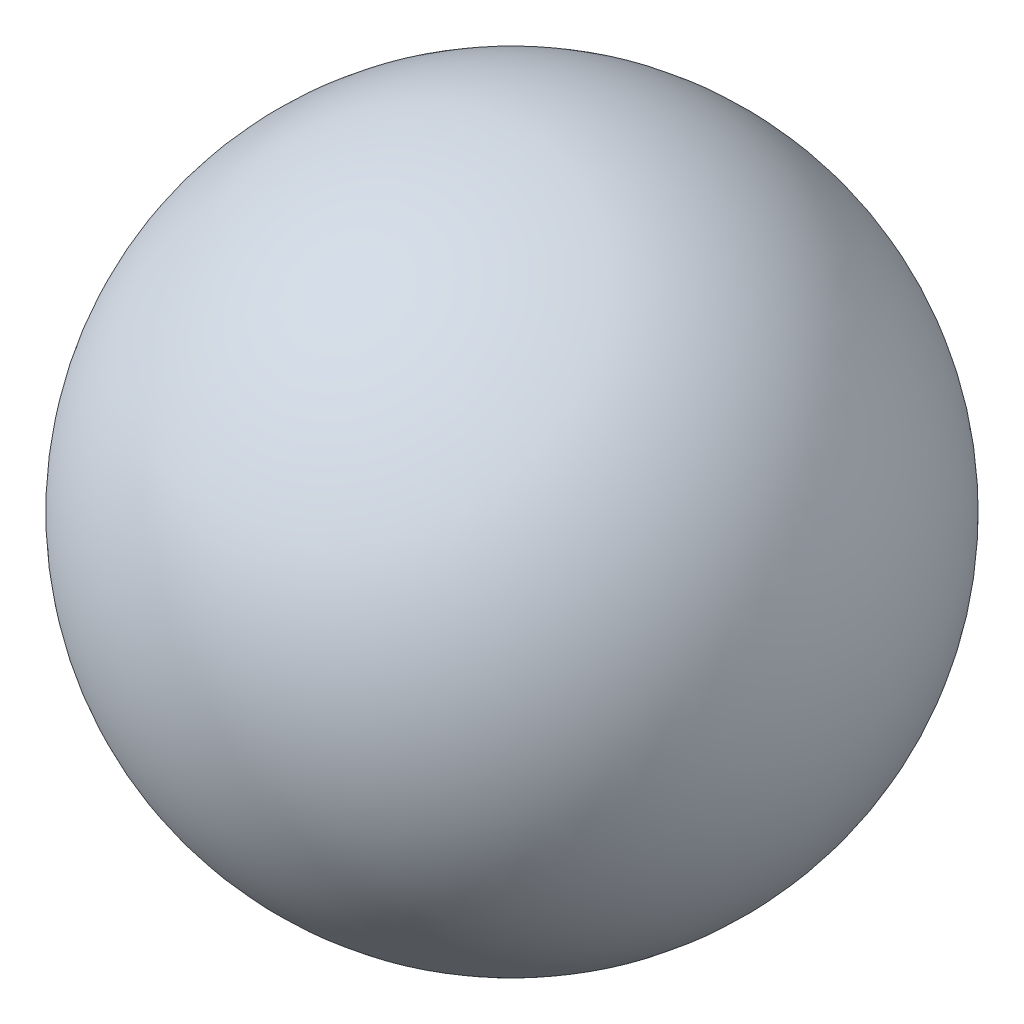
SolidWorks part; units mm, degrees
ref_plane "Front Plane" through (0, 0, 0) normal (0, 0, 1) x (1, 0, 0)
ref_plane "Top Plane" through (0, 0, 0) normal (0, 1, 0) x (1, 0, 0)
ref_plane "Right Plane" through (0, 0, 0) normal (1, 0, 0) x (0, 0, -1)
ref_axis "Axis1" through (0, -17.4625, 0) along (0, 1, 0)
sketch "Sketch1" plane through (0, 0, 0) normal (0, 0, 1) x (1, 0, 0)
  arc A0 (0, 12.7) -> (0, -12.7) centre (0, 0) ccw
  dimension "D1" = 25.4
revolve "Revolve-Thin1" add sketch "Sketch1" angle 360 about axis through (0, -17.4625, 0) along (0, 1, 0)
